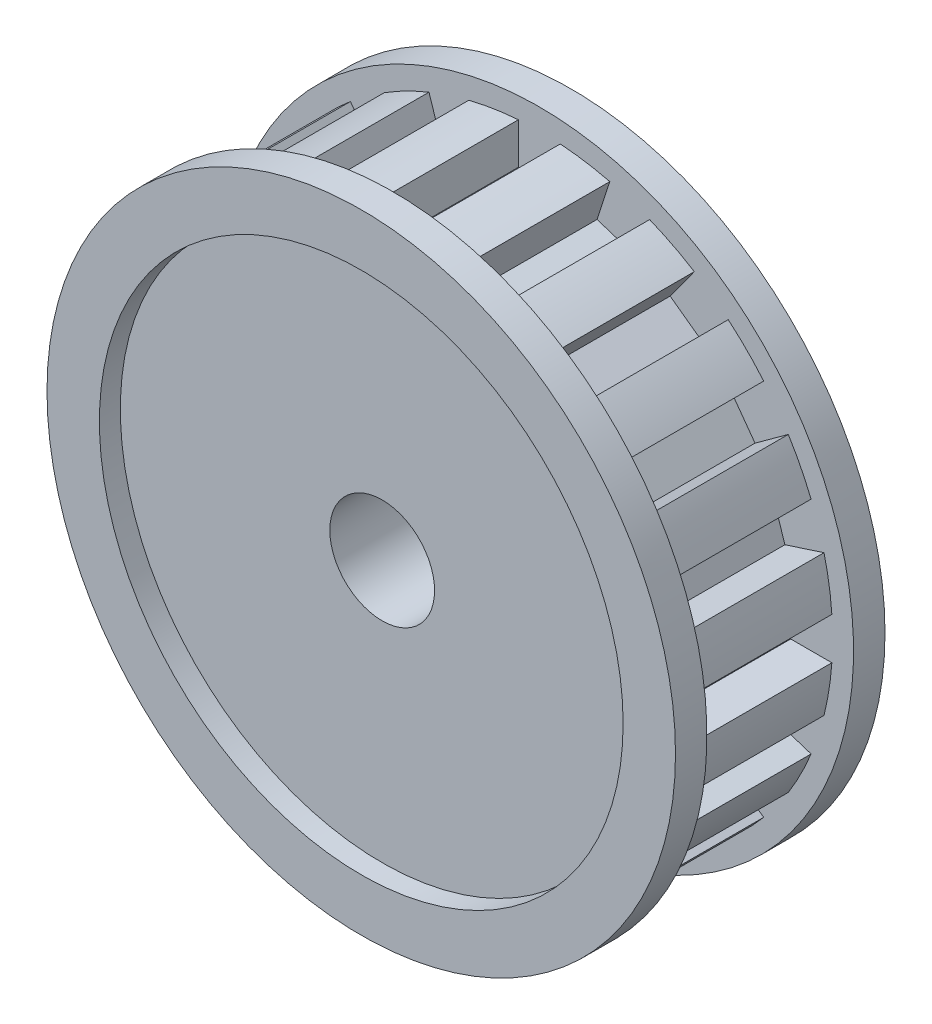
SolidWorks part; units mm, degrees
ref_plane "Front Plane" through (0, 0, 0) normal (0, 0, 1) x (1, 0, 0)
ref_plane "Top Plane" through (0, 0, 0) normal (0, 1, 0) x (1, 0, 0)
ref_plane "Right Plane" through (0, 0, 0) normal (1, 0, 0) x (0, 0, -1)
sketch "Sketch1" plane through (0, 0, 0) normal (0, 0, 1) x (1, 0, 0)
  line L0 (-1.5, 2) -> (1.5, 2)
  arc A0 (-1.5, 2) -> (1.5, 2) centre (0, 0) ccw
  circle A1 centre (0, 0) radius 15
  point P6 (0, -2.5)
  dimension "D1" = 5
  dimension "D3" = 30
  dimension "D2" = 4.5
extrude "Boss-Extrude1" add sketch "Sketch1" along normal blind 10
sketch "Sketch2" plane through (0, 0, 10) normal (0, 0, 1) x (1, 0, 0)
  line L0 (2.7571, 11.7217) -> (4.6593, 11.1037)
  line L1 (-1, 18) -> (1, 18)
  line L2 (-1, 18) -> (-1, 12)
  line L3 (-1, 12) -> (1, 12)
  line L4 (1, 18) -> (1, 12)
  line L5 (-1, 18) -> (1, 12) construction
  line L6 (-1, 12) -> (1, 18) construction
  line L7 (4.6112, 17.428) -> (2.7571, 11.7217)
  line L8 (6.5134, 16.81) -> (4.6593, 11.1037)
  line L9 (4.6112, 17.428) -> (6.5134, 16.81)
  line L10 (6.2444, 10.296) -> (7.8624, 9.1204)
  line L11 (9.7711, 15.1501) -> (6.2444, 10.296)
  line L12 (11.3892, 13.9745) -> (7.8624, 9.1204)
  line L13 (9.7711, 15.1501) -> (11.3892, 13.9745)
  line L14 (9.1204, 7.8624) -> (10.296, 6.2444)
  line L15 (13.9745, 11.3892) -> (9.1204, 7.8624)
  line L16 (15.1501, 9.7711) -> (10.296, 6.2444)
  line L17 (13.9745, 11.3892) -> (15.1501, 9.7711)
  line L18 (11.1037, 4.6593) -> (11.7217, 2.7571)
  line L19 (16.81, 6.5134) -> (11.1037, 4.6593)
  line L20 (17.428, 4.6112) -> (11.7217, 2.7571)
  line L21 (16.81, 6.5134) -> (17.428, 4.6112)
  line L22 (12, 1) -> (12, -1)
  line L23 (18, 1) -> (12, 1)
  line L24 (18, -1) -> (12, -1)
  line L25 (18, 1) -> (18, -1)
  line L26 (11.7217, -2.7571) -> (11.1037, -4.6593)
  line L27 (17.428, -4.6112) -> (11.7217, -2.7571)
  line L28 (16.81, -6.5134) -> (11.1037, -4.6593)
  line L29 (17.428, -4.6112) -> (16.81, -6.5134)
  line L30 (10.296, -6.2444) -> (9.1204, -7.8624)
  line L31 (15.1501, -9.7711) -> (10.296, -6.2444)
  line L32 (13.9745, -11.3892) -> (9.1204, -7.8624)
  line L33 (15.1501, -9.7711) -> (13.9745, -11.3892)
  line L34 (7.8624, -9.1204) -> (6.2444, -10.296)
  line L35 (11.3892, -13.9745) -> (7.8624, -9.1204)
  line L36 (9.7711, -15.1501) -> (6.2444, -10.296)
  line L37 (11.3892, -13.9745) -> (9.7711, -15.1501)
  line L38 (4.6593, -11.1037) -> (2.7571, -11.7217)
  line L39 (6.5134, -16.81) -> (4.6593, -11.1037)
  line L40 (4.6112, -17.428) -> (2.7571, -11.7217)
  line L41 (6.5134, -16.81) -> (4.6112, -17.428)
  line L42 (1, -12) -> (-1, -12)
  line L43 (1, -18) -> (1, -12)
  line L44 (-1, -18) -> (-1, -12)
  line L45 (1, -18) -> (-1, -18)
  line L46 (-2.7571, -11.7217) -> (-4.6593, -11.1037)
  line L47 (-4.6112, -17.428) -> (-2.7571, -11.7217)
  line L48 (-6.5134, -16.81) -> (-4.6593, -11.1037)
  line L49 (-4.6112, -17.428) -> (-6.5134, -16.81)
  line L50 (-6.2444, -10.296) -> (-7.8624, -9.1204)
  line L51 (-9.7711, -15.1501) -> (-6.2444, -10.296)
  line L52 (-11.3892, -13.9745) -> (-7.8624, -9.1204)
  line L53 (-9.7711, -15.1501) -> (-11.3892, -13.9745)
  line L54 (-9.1204, -7.8624) -> (-10.296, -6.2444)
  line L55 (-13.9745, -11.3892) -> (-9.1204, -7.8624)
  line L56 (-15.1501, -9.7711) -> (-10.296, -6.2444)
  line L57 (-13.9745, -11.3892) -> (-15.1501, -9.7711)
  line L58 (-11.1037, -4.6593) -> (-11.7217, -2.7571)
  line L59 (-16.81, -6.5134) -> (-11.1037, -4.6593)
  line L60 (-17.428, -4.6112) -> (-11.7217, -2.7571)
  line L61 (-16.81, -6.5134) -> (-17.428, -4.6112)
  line L62 (-12, -1) -> (-12, 1)
  line L63 (-18, -1) -> (-12, -1)
  line L64 (-18, 1) -> (-12, 1)
  line L65 (-18, -1) -> (-18, 1)
  line L66 (-11.7217, 2.7571) -> (-11.1037, 4.6593)
  line L67 (-17.428, 4.6112) -> (-11.7217, 2.7571)
  line L68 (-16.81, 6.5134) -> (-11.1037, 4.6593)
  line L69 (-17.428, 4.6112) -> (-16.81, 6.5134)
  line L70 (-10.296, 6.2444) -> (-9.1204, 7.8624)
  line L71 (-15.1501, 9.7711) -> (-10.296, 6.2444)
  line L72 (-13.9745, 11.3892) -> (-9.1204, 7.8624)
  line L73 (-15.1501, 9.7711) -> (-13.9745, 11.3892)
  line L74 (-7.8624, 9.1204) -> (-6.2444, 10.296)
  line L75 (-11.3892, 13.9745) -> (-7.8624, 9.1204)
  line L76 (-9.7711, 15.1501) -> (-6.2444, 10.296)
  line L77 (-11.3892, 13.9745) -> (-9.7711, 15.1501)
  line L78 (-4.6593, 11.1037) -> (-2.7571, 11.7217)
  line L79 (-6.5134, 16.81) -> (-4.6593, 11.1037)
  line L80 (-4.6112, 17.428) -> (-2.7571, 11.7217)
  line L81 (-6.5134, 16.81) -> (-4.6112, 17.428)
  circle A0 centre (0, 0) radius 15
  point P3 (0, 15)
  point P8 (0, 12)
  point P88 (0, 0)
  dimension "D1" = 2
  dimension "D2" = 3
  dimension "D3" = 20
extrude "Cut-Extrude1" cut sketch "Sketch2" against normal blind 7 from offset 1.5 contours L8 L0 L7 L9 | L4 L3 L2 L1 | L80 L78 L79 L81 | L76 L74 L75 L77 | L72 L70 L71 L73 | L68 L66 L67 L69 | L64 L62 L63 L65 | L60 L58 L59 L61 | L56 L54 L55 L57 | L52 L50 L51 L53 | L48 L46 L47 L49 | L44 L42 L43 L45 | L39 L38 L40 L41 | L35 L34 L36 L37 | L31 L30 L32 L33 | L27 L26 L28 L29 | L23 L22 L24 L25 | L19 L18 L20 L21 | L15 L14 L16 L17 | L12 L10 L11 L13
sketch "Sketch3" plane through (0, 0, 10) normal (0, 0, 1) x (1, 0, 0)
  line L0 (1.5, 2) -> (-1.5, 2) construction
  line L1 (1.5, 2) -> (-1.5, 2)
  circle A1 centre (0, 0) radius 12.5
  arc A2 (-1.5, 2) -> (1.5, 2) centre (0, 0) ccw
  dimension "D1" = 25
extrude "Cut-Extrude2" cut sketch "Sketch3" against normal blind 1
sketch "Sketch4" plane through (0, 0, 0) normal (0, 0, -1) x (-1, 0, 0)
  line L1 (1.5, 2) -> (-1.5, 2)
  line L2 (1.5, 2) -> (-1.5, 2)
  circle A1 centre (0, 0) radius 12.5
  circle A2 centre (0, 0) radius 12.5
  arc A3 (-1.5, 2) -> (1.5, 2) centre (0, 0) ccw
  arc A4 (-1.5, 2) -> (1.5, 2) centre (0, 0) ccw
  dimension "D1" = 0
  dimension "D2" = 0
extrude "Cut-Extrude3" cut sketch "Sketch4" against normal blind 1
sketch "Sketch5" plane through (0, 0, 9) normal (0, 0, 1) x (1, 0, 0)
  circle A0 centre (0, 0) radius 15 construction
  circle A1 centre (0, 0) radius 15
  circle A2 centre (0, 0) radius 14
  dimension "D1" = 28
extrude "Cut-Extrude4" cut sketch "Sketch5" against normal blind 7 from offset 0.5
sketch "Sketch6" plane through (0, 0, 9) normal (0, 0, 1) x (1, 0, 0)
  circle A0 centre (0, 0) radius 2.5
extrude "Cut-Extrude5" cut sketch "Sketch6" against normal blind 10
